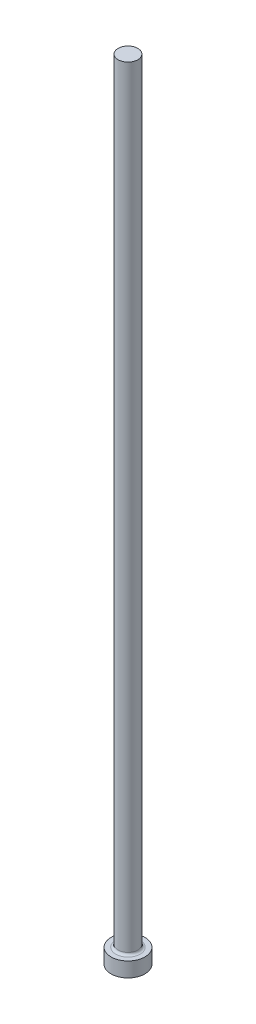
SolidWorks part; units mm, degrees
ref_plane "Front Plane" through (0, 0, 0) normal (0, 0, 1) x (1, 0, 0)
ref_plane "Top Plane" through (0, 0, 0) normal (0, 1, 0) x (1, 0, 0)
ref_plane "Right Plane" through (0, 0, 0) normal (1, 0, 0) x (0, 0, -1)
sketch "Sketch1" plane through (0, 0, 0) normal (0, 0, 1) x (1, 0, 0)
  line L0 (0, 0) -> (5.461, 0)
  line L1 (55, 0) -> (-55, 0) construction
  line L2 (5.461, 0) -> (5.461, 4.7498)
  line L3 (5.461, 4.7498) -> (3.937, 4.7498)
  line L4 (3.175, 5.5118) -> (3.175, 254)
  line L5 (3.175, 254) -> (0, 254)
  line L6 (0, 254) -> (0, 0)
  arc A0 (3.937, 4.7498) -> (3.175, 5.5118) centre (3.937, 5.5118) cw
  dimension "D5" = 0.762
  dimension "D1" = 3.175
  dimension "D2" = 5.461
  dimension "D3" = 4.7498
  dimension "D4" = 254
revolve "Revolve1" add sketch "Sketch1" angle 360 about L6
